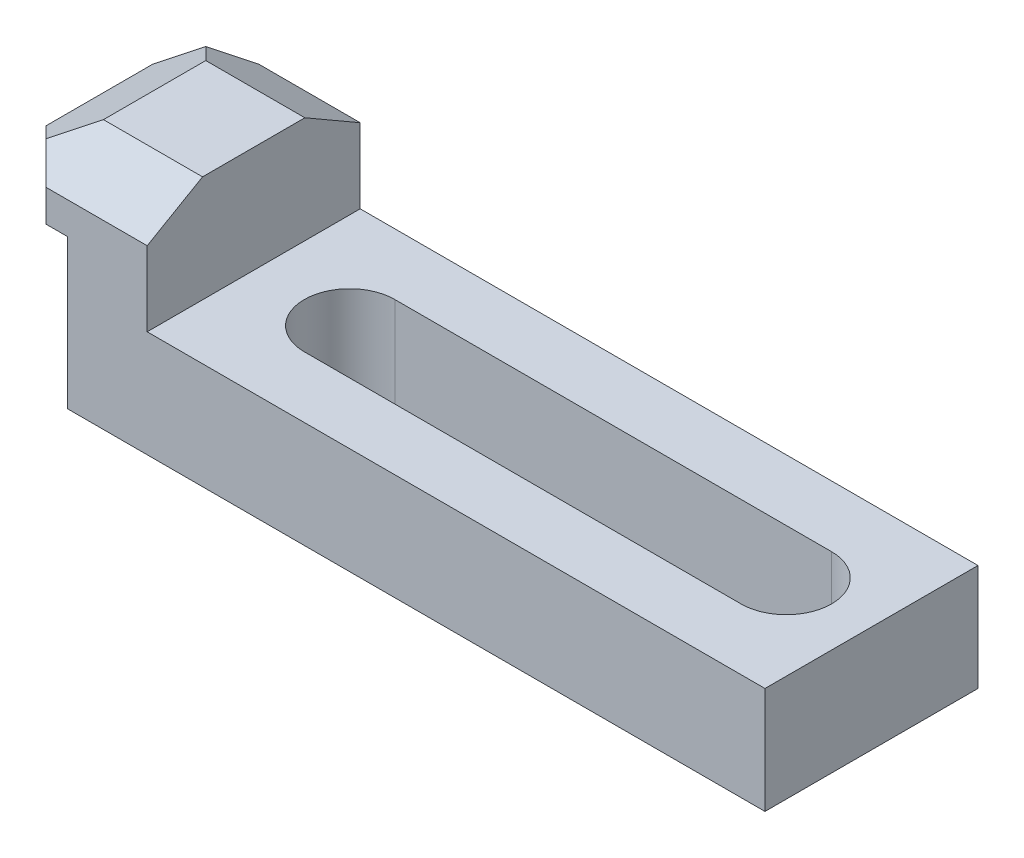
SolidWorks part; units mm, degrees
ref_plane "Front Plane" through (0, 0, 0) normal (0, 0, 1) x (1, 0, 0)
ref_plane "Top Plane" through (0, 0, 0) normal (0, 1, 0) x (1, 0, 0)
ref_plane "Right Plane" through (0, 0, 0) normal (1, 0, 0) x (0, 0, -1)
sketch "Sketch1" plane through (0, 0, 0) normal (0, 0, 1) x (1, 0, 0)
  line L0 (0, 0) -> (14, 0)
  line L1 (14, 0) -> (14, -28)
  line L2 (14, -28) -> (145, -28)
  line L3 (145, -28) -> (145, -8)
  line L4 (145, -8) -> (29, -8)
  line L5 (29, -8) -> (29, 12)
  line L6 (29, 12) -> (0, 12)
  line L7 (0, 12) -> (0, 0)
  dimension "D1" = 14
  dimension "D2" = 28
  dimension "D3" = 145
  dimension "D4" = 29
  dimension "D5" = 20
  dimension "D6" = 40
extrude "Extrude1" add sketch "Sketch1" along normal mid plane 40
chamfer "Chamfer1" distance 6 angle 60 4 edges at (14.5, 12, -20) (0, 12, 0) (14.5, 12, 20) (29, 12, 0)
sketch "Sketch2" plane through (0, -28, 0) normal (0, -1, 0) x (1, 0, 0)
  line L0 (0, 0) -> (50000, 0) construction
  line L1 (47, 8.5) -> (129, 8.5)
  line L2 (0, 20) -> (10, 20)
  line L4 (10, 20) -> (0, 10)
  line L5 (0, 20) -> (0, -20) construction
  line L6 (0, 10) -> (0, 20)
  line L7 (47, -8.5) -> (129, -8.5)
  line L8 (0, -10) -> (0, -20)
  line L9 (10, -20) -> (0, -10)
  line L10 (0, -20) -> (10, -20)
  arc A0 (47, 8.5) -> (47, -8.5) centre (47, 0) ccw
  arc A1 (129, -8.5) -> (129, 8.5) centre (129, 0) ccw
  point P18 (38.5, 0)
  point P19 (137.5, 0)
  dimension "D1" = 45
  dimension "D2" = 20
  dimension "D3" = 38.5
  dimension "D4" = 17
  dimension "D5" = 99
extrude "Extrude2" cut sketch "Sketch2" against normal through all
